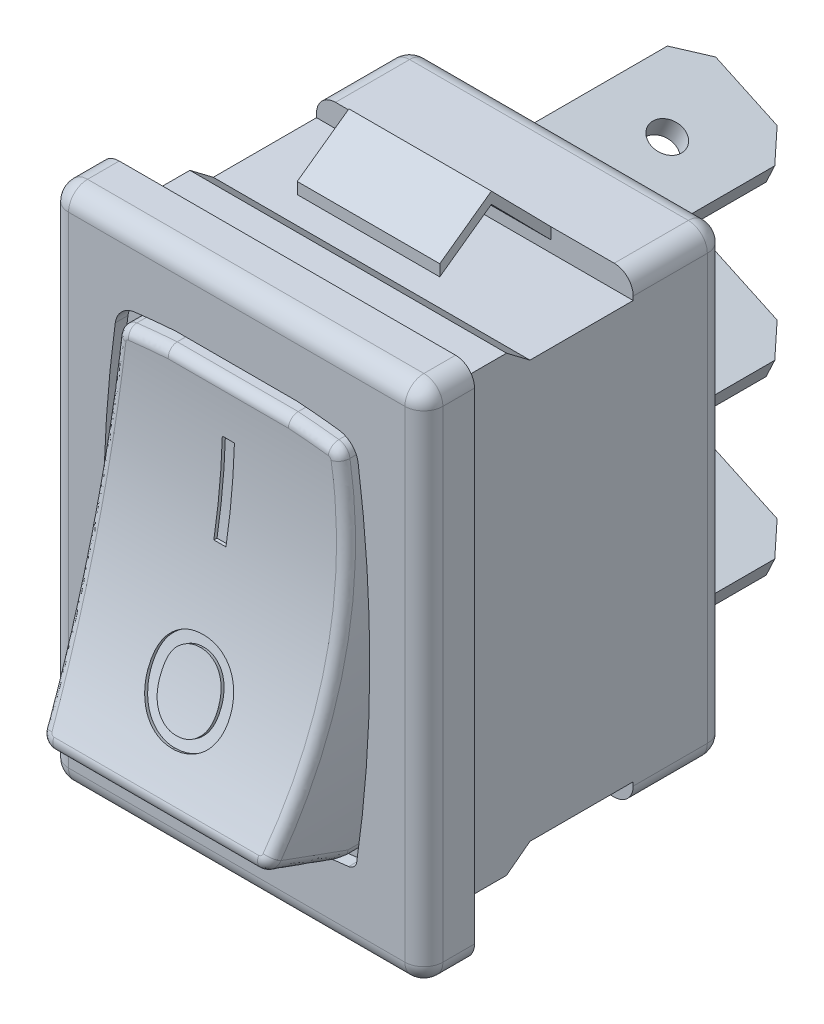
SolidWorks part; units mm, degrees
ref_plane "Plane1" through (0, 0, 0) normal (0, 0, 1) x (1, 0, 0)
ref_plane "Plane2" through (0, 0, 0) normal (0, 1, 0) x (1, 0, 0)
ref_plane "Plane3" through (0, 0, 0) normal (1, 0, 0) x (0, 0, -1)
sketch "Sketch1" plane through (0, 0, 0) normal (0, 0, 1) x (1, 0, 0)
  line L4 (-12.4587, 10.414) -> (2.5527, 10.414)
  line L5 (-12.4587, 10.414) -> (-12.4587, -10.414)
  line L6 (2.5527, -10.414) -> (-12.4587, -10.414)
  line L7 (2.5527, -10.414) -> (2.5527, 10.414)
  point P0 (-4.953, 10.414)
  dimension "D1" = 15.0114
  dimension "D2" = 20.828
  dimension "D3" = 2.5527
  dimension "D4" = 10.414
extrude "Base-Extrude" add sketch "Sketch1" against normal blind 2.032
sketch "Sketch2" plane through (0, 0, -2.032) normal (0, 0, -1) x (-1, 0, 0)
  line L0 (-1.397, 9.271) -> (11.303, 9.271)
  line L1 (-1.397, 9.271) -> (-1.397, -9.271)
  line L2 (11.303, -9.271) -> (-1.397, -9.271)
  line L3 (11.303, -9.271) -> (11.303, 9.271)
  line L4 (4.953, -10.414) -> (4.953, 11.0998) construction
  line L5 (-2.5527, -10.414) -> (12.4587, -10.414) construction
  line L6 (12.4587, 10.414) -> (-2.5527, 10.414) construction
  dimension "D1" = 6.35
  dimension "D2" = 6.35
  dimension "D3" = 18.542
  dimension "D4" = 1.143
extrude "Boss-Extrude1" add sketch "Sketch2" along normal blind 11.2522
sketch "Sketch3" plane through (1.397, 0, 0) normal (1, 0, 0) x (0, 0, -1)
  line L0 (9.5504, 9.271) -> (9.5504, 8.3566)
  line L2 (9.5504, 9.271) -> (2.032, 9.271)
  line L3 (9.5504, 8.3566) -> (5.4102, 8.3566)
  line L5 (5.4102, 8.3566) -> (4.4704, 9.0678)
  line L6 (4.4704, 9.0678) -> (2.032, 9.0678)
  line L7 (2.032, -10.414) -> (2.032, 10.414) construction
  line L8 (2.032, 9.271) -> (2.032, 9.0678)
extrude "Cut-Extrude1" cut sketch "Sketch3" against normal through all
mirror "Mirror1" about plane through (0, 0, 0) normal (0, 1, 0) of "Cut-Extrude1"
ref_plane "Plane4" through (2.5527, 0, 0) normal (1, 0, 0) x (0, 0, -1)
ref_plane "Plane5" through (-1.8923, 0, 0) normal (1, 0, 0) x (0, 0, -1)
sketch "Sketch4" plane through (-1.8923, 0, 0) normal (1, 0, 0) x (0, 0, -1)
  line L0 (2.032, -10.414) -> (2.032, 10.414) construction
  line L2 (9.5504, 9.271) -> (7.1529, 11.7103)
  line L3 (7.1529, 11.7103) -> (5.082, 10.2238)
  line L5 (5.082, 10.2238) -> (5.082, 9.7666)
  line L6 (9.5504, 9.271) -> (9.5504, 8.8138)
  line L8 (9.5504, 8.8138) -> (7.1529, 11.2531)
  line L9 (7.1529, 11.2531) -> (5.082, 9.7666)
  dimension "D1" = 0.4572
  dimension "D2" = 3.05
extrude "Boss-Extrude2" add sketch "Sketch4" against normal blind 5.715
mirror "Mirror2" about plane through (0, 0, 0) normal (0, 1, 0) of "Boss-Extrude2"
sketch "Sketch5" plane through (0, 0, 0) normal (0, 0, 1) x (1, 0, 0)
  line L0 (0, -7.3787) -> (0, 7.3787) construction
  line L1 (0, 0) -> (-9.906, 0) construction
  line L2 (0, 7.3787) -> (-9.906, 7.3787) construction
  line L3 (0, -7.3787) -> (-9.906, -7.3787) construction
  line L4 (-9.906, 7.3787) -> (-9.906, -7.3787) construction
  line L5 (-4.953, 7.3787) -> (-4.953, -7.3787) construction
  arc A0 (-9.3903, 7.08) -> (-0.5157, 7.08) centre (-4.953, -25.7343) cw
  arc A1 (-9.3903, -7.08) -> (-0.5157, -7.08) centre (-4.953, 25.7343) ccw
  arc A2 (-0.5157, 7.08) -> (-0.5157, -7.08) centre (-48.8581, 0) cw
  arc A3 (-9.3903, 7.08) -> (-9.3903, -7.08) centre (38.9521, 0) ccw
  dimension "D1" = 14.7574
  dimension "D2" = 9.906
extrude "Boss-Extrude3" add sketch "Sketch5" along normal blind 3.5052
ref_plane "Plane6" through (-4.953, 0, 0) normal (1, 0, 0) x (0, 0, -1)
sketch "Sketch6" plane through (-4.953, 0, 0) normal (1, 0, 0) x (0, 0, -1)
  line L0 (0, -7.366) -> (-3.429, -6.0242)
  line L1 (0, -10.414) -> (0, 10.414) construction
  line L3 (-0.3556, 7.2898) -> (0, 7.2898)
  line L4 (0, 7.2898) -> (0, 7.3787)
  line L5 (0, 7.3787) -> (-3.5052, 7.3787)
  line L6 (-3.5052, 7.08) -> (-3.5052, -7.08) construction
  line L7 (-3.5052, -7.3787) -> (0, -7.3787)
  line L8 (0, -7.3787) -> (0, -7.366)
  line L9 (-3.5052, 7.3787) -> (-3.5052, -7.3787)
  line L12 (-3.5052, -7.3787) -> (0, -7.3787) construction
  line L13 (0, 7.3787) -> (-3.5052, 7.3787) construction
  arc A0 (-3.429, -6.0242) -> (-0.3556, 7.2898) centre (-25.1635, 6.0047) ccw
  dimension "D1" = 24.8412
extrude "Cut-Extrude9" cut sketch "Sketch6" along normal up to surface and the other way up to surface
fillet "Fillet10" radius 0.762 8 edges at (-4.953, 10.414, 0) (2.5527, 0, 0) (-4.953, -10.414, 0) (-12.4587, 0, 0) (-12.4587, 10.414, -1.016) (2.5527, 10.414, -1.016) (2.5527, -10.414, -1.016) (-12.4587, -10.414, -1.016)
fillet "Fillet11" radius 0.762 8 edges at (1.397, 9.271, -11.4173) (-4.953, -9.271, -13.2842) (1.397, -9.271, -11.4173) (-11.303, -9.271, -11.4173) (-4.953, 9.271, -13.2842) (-11.303, 9.271, -11.4173) (1.397, 0, -13.2842) (-11.303, 0, -13.2842)
sketch "Sketch8" plane through (0, 0, -13.2842) normal (0, 0, -1) x (-1, 0, 0)
  line L2 (8.763, -7.366) -> (1.143, -7.366)
  line L3 (8.763, -7.366) -> (8.763, -6.4008)
  line L4 (1.143, -6.4008) -> (8.763, -6.4008)
  line L5 (1.143, -6.4008) -> (1.143, -7.366)
  line L8 (8.763, -0.3556) -> (1.143, -0.3556)
  line L9 (8.763, -0.3556) -> (8.763, 0.6096)
  line L10 (1.143, 0.6096) -> (8.763, 0.6096)
  line L11 (1.143, 0.6096) -> (1.143, -0.3556)
  line L12 (8.763, 6.4008) -> (1.143, 6.4008)
  line L13 (8.763, 6.4008) -> (8.763, 7.366)
  line L14 (1.143, 7.366) -> (8.763, 7.366)
  line L15 (1.143, 7.366) -> (1.143, 6.4008)
extrude "Cut-Extrude4" cut sketch "Sketch8" against normal blind 0.254
sketch "Sketch9" plane through (0, 0, -13.2842) normal (0, 0, -1) x (-1, 0, 0)
  line L0 (6.858, -5.3992) -> (2.5532, -7.4066)
  line L1 (6.858, -5.3992) -> (7.2015, -6.1359)
  line L2 (7.2015, -6.1359) -> (2.8967, -8.1432)
  line L3 (2.5532, -7.4066) -> (2.8967, -8.1432)
  line L4 (6.858, 1.4994) -> (2.5532, -0.508)
  line L5 (6.858, 1.4994) -> (7.2015, 0.7628)
  line L6 (6.858, 8.255) -> (2.5532, 6.2476)
  line L7 (6.858, 8.255) -> (7.2015, 7.5184)
  line L8 (7.2015, 7.5184) -> (2.8967, 5.511)
  line L9 (2.5532, 6.2476) -> (2.8967, 5.511)
  line L10 (7.2015, 0.7628) -> (2.8967, -1.2446)
  line L11 (2.5532, -0.508) -> (2.8967, -1.2446)
  line L12 (4.7056, -6.4029) -> (5.0491, -7.1395) construction
extrude "Boss-Extrude4" add sketch "Sketch9" along normal blind 6.9088
chamfer "Chamfer1" distance 1.016 angle 45 6 edges at (-7.0298, -5.7675, -20.193) (-2.725, -7.7749, -20.193) (-7.0298, 1.1311, -20.193) (-2.725, -0.8763, -20.193) (-7.0298, 7.8867, -20.193) (-2.725, 5.8793, -20.193)
sketch "Sketch10" plane through (1.937, 4.1538, 0) normal (0.4226, 0.9063, 0) x (-0.9063, 0.4226, 0)
  line L0 (9.7042, -19.177) -> (9.7042, -13.2842) construction
  line L1 (8.6882, -20.193) -> (5.9704, -20.193) construction
  circle A0 centre (7.3293, -17.018) radius 0.635
  dimension "D1" = 1.27
  dimension "D2" = 2.3749
  dimension "D3" = 3.175
extrude "Cut-Extrude5" cut sketch "Sketch10" against normal up to next
sketch "Sketch11" plane through (-0.6506, -1.3952, 0) normal (0.4226, 0.9063, 0) x (-0.9063, 0.4226, 0)
  line L0 (6.8491, -19.177) -> (6.8491, -13.2842) construction
  line L1 (5.8331, -20.193) -> (3.1153, -20.193) construction
  circle A0 centre (4.4742, -17.018) radius 0.635
  dimension "D1" = 1.27
  dimension "D2" = 2.3749
  dimension "D3" = 3.175
extrude "Cut-Extrude6" cut sketch "Sketch11" against normal up to next
fillet "Fillet12" radius 0.508 10 edges at (-0.5157, -7.08, 0.3654) (-9.3903, -7.08, 0.3654) (-7.634, -7.27, 0.2454) (-9.3903, 7.08, 0.1728) (-0.5157, 7.08, 0.1728) (-0.4414, -6.5525, 2.0789) (-0.0126, 1.111, 0.8091) (-9.9053, -0.2544, 1.1238) (-9.4646, -6.5525, 2.0789)
sketch "Sketch15" plane through (0, 0, 0) normal (0, 0, 1) x (1, 0, 0)
  line L0 (-5.8753, -7.747) -> (-4.0307, -7.747)
  line L1 (-2.5143, 7.6708) -> (-7.3917, 7.6708)
  line L2 (-5.87, -7.366) -> (-4.036, -7.366)
  line L3 (-2.5282, 7.2898) -> (-7.3778, 7.2898)
  line L4 (-5.87, -7.366) -> (-4.036, -7.366)
  line L5 (-2.5282, 7.2898) -> (-7.3778, 7.2898)
  arc A0 (-4.0307, -7.747) -> (-0.4647, -7.4576) centre (-4.953, 25.7343) ccw
  arc A1 (-9.4413, -7.4576) -> (-5.8753, -7.747) centre (-4.953, 25.7343) ccw
  arc A2 (-9.8225, 6.7476) -> (-9.7673, -7.1353) centre (38.9521, 0) ccw
  arc A3 (-9.0506, 7.5081) -> (-9.8225, 6.7476) centre (-8.9419, 6.6258) ccw
  arc A4 (-7.3917, 7.6708) -> (-9.0506, 7.5081) centre (-4.953, -25.7343) ccw
  arc A5 (-0.8554, 7.5081) -> (-2.5143, 7.6708) centre (-4.953, -25.7343) ccw
  arc A6 (-0.0835, 6.7476) -> (-0.8554, 7.5081) centre (-0.9641, 6.6258) ccw
  arc A7 (-0.1387, -7.1353) -> (-0.0835, 6.7476) centre (-48.8581, 0) ccw
  arc A8 (-4.036, -7.366) -> (-0.5515, -7.0849) centre (-4.953, 25.7343) ccw
  arc A9 (-9.3545, -7.0849) -> (-5.87, -7.366) centre (-4.953, 25.7343) ccw
  arc A10 (-9.4451, 6.6954) -> (-9.4174, -6.8922) centre (38.9521, 0) ccw
  arc A11 (-9.004, 7.13) -> (-9.4451, 6.6954) centre (-8.9419, 6.6258) ccw
  arc A12 (-7.3778, 7.2898) -> (-9.004, 7.13) centre (-4.953, -25.7343) ccw
  arc A13 (-0.902, 7.13) -> (-2.5282, 7.2898) centre (-4.953, -25.7343) ccw
  arc A14 (-0.4609, 6.6954) -> (-0.902, 7.13) centre (-0.9641, 6.6258) ccw
  arc A15 (-0.4886, -6.8922) -> (-0.4609, 6.6954) centre (-48.8581, 0) ccw
  arc A16 (-4.036, -7.366) -> (-0.5515, -7.0849) centre (-4.953, 25.7343) ccw
  arc A17 (-9.3545, -7.0849) -> (-5.87, -7.366) centre (-4.953, 25.7343) ccw
  arc A18 (-9.4451, 6.6954) -> (-9.4174, -6.8922) centre (38.9521, 0) ccw
  arc A19 (-9.004, 7.13) -> (-9.4451, 6.6954) centre (-8.9419, 6.6258) ccw
  arc A20 (-7.3778, 7.2898) -> (-9.004, 7.13) centre (-4.953, -25.7343) ccw
  arc A21 (-0.902, 7.13) -> (-2.5282, 7.2898) centre (-4.953, -25.7343) ccw
  arc A22 (-0.4609, 6.6954) -> (-0.902, 7.13) centre (-0.9641, 6.6258) ccw
  arc A23 (-0.4886, -6.8922) -> (-0.4609, 6.6954) centre (-48.8581, 0) ccw
  arc A24 (-0.1387, -7.1353) -> (-0.4647, -7.4576) centre (-0.5157, -7.08) cw
  arc A25 (-9.7673, -7.1353) -> (-9.4413, -7.4576) centre (-9.3903, -7.08) ccw
  spline S2 degree 3 poles (-9.4174, -6.8922) (-9.4078, -6.9601) (-9.3869, -7.0244) (-9.3545, -7.0849) knots 0 0 0 0 1 1 1 1
  spline S3 degree 3 poles (-0.5515, -7.0849) (-0.5191, -7.0244) (-0.4982, -6.9601) (-0.4886, -6.8922) knots 0 0 0 0 1 1 1 1
  spline S4 degree 3 poles (-9.4174, -6.8922) (-9.4078, -6.9601) (-9.3869, -7.0244) (-9.3545, -7.0849) knots 0 0 0 0 1 1 1 1
  spline S5 degree 3 poles (-0.5515, -7.0849) (-0.5191, -7.0244) (-0.4982, -6.9601) (-0.4886, -6.8922) knots 0 0 0 0 1 1 1 1
  dimension "D3" = 0.381
  dimension "D1" = 0
  dimension "D2" = 0.381
extrude "Cut-Extrude10" cut sketch "Sketch15" against normal blind 0.508
fillet "Fillet13" radius 0.381 12 edges at (-4.953, 7.2898, 0.3556) (-4.953, -6.0242, 3.429) (-9.0106, -6.5816, 2.0045) (-9.9053, -0.2544, 1.1238) (-0.0126, 1.111, 0.8091) (-0.6148, 6.9946, 0.3421) (-9.3052, 6.9808, 0.3415) (-9.4374, -5.8923, 3.3565) (-0.5131, -5.9276, 3.3758)
sketch "Sketch16" plane through (-3.2929, -7.0616, 0) normal (0.4226, 0.9063, 0) x (-0.9063, 0.4226, 0)
  circle A0 centre (1.651, -17.018) radius 0.635
  circle A1 centre (4.4742, -17.018) radius 0.635 construction
extrude "Cut-Extrude11" cut sketch "Sketch16" against normal up to next
ref_plane "Plane7" through (0, 0, 3.175) normal (0, 0, 1) x (1, 0, 0)
sketch "Sketch17" plane through (0, 0, 3.175) normal (0, 0, 1) x (1, 0, 0)
  text T0 "I"
extrude "Cut-Extrude15" cut sketch "Sketch17" against normal offset from surface (2.9695 mm away) 0.127
ref_plane "Plane8" through (0, 0.5651, 1.5527) normal (0, 0.342, 0.9397) x (1, 0, 0)
sketch "Sketch18" plane through (0, 0.5651, 1.5527) normal (0, 0.342, 0.9397) x (1, 0, 0)
  text T0 "O"
extrude "Cut-Extrude17" cut sketch "Sketch18" against normal offset from surface (0.92 mm away) 0.127
ref_plane "Plane9" through (-6.6426, 3.0975, 0) normal (0.9063, -0.4226, 0) x (0, 0, -1)
ref_plane "Plane10" through (-4.055, 1.8909, 0) normal (0.9063, -0.4226, 0) x (0, 0, -1)
ref_plane "Plane11" through (-1.4127, 0.6588, 0) normal (0.9063, -0.4226, 0) x (0, 0, -1)
ref_plane "Plane12" through (1.7652, 3.7855, 0) normal (-0.4226, -0.9063, 0) x (0.9063, -0.4226, 0)
ref_plane "Plane13" through (-0.8223, -1.7635, 0) normal (-0.4226, -0.9063, 0) x (0.9063, -0.4226, 0)
ref_plane "Plane14" through (-3.4647, -7.43, 0) normal (-0.4226, -0.9063, 0) x (0.9063, -0.4226, 0)
